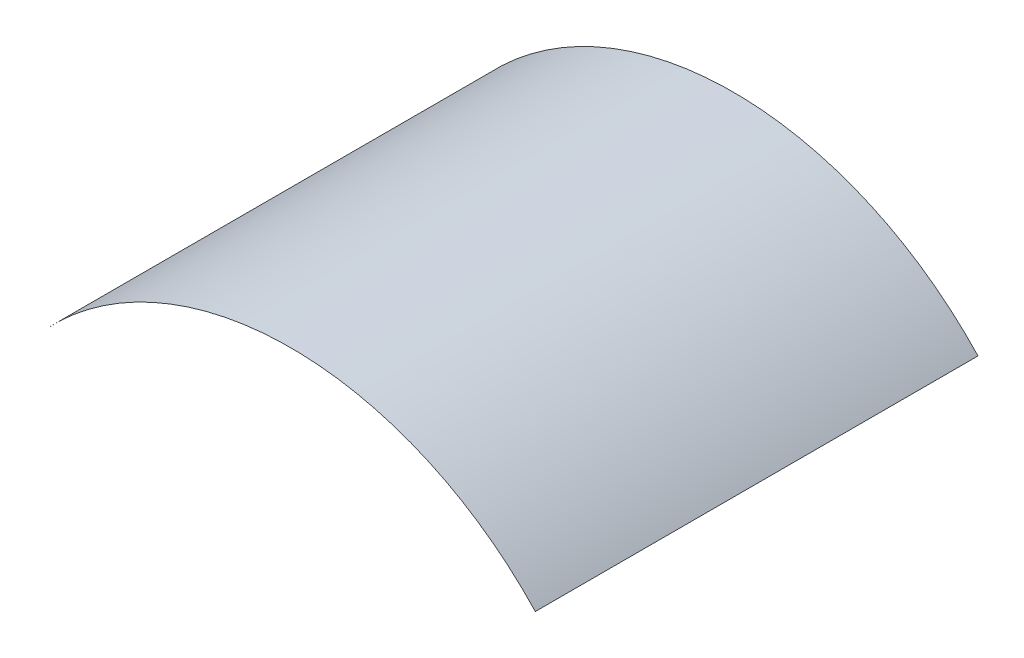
SolidWorks part; units mm, degrees
ref_plane "Front" through (0, 0, 0) normal (0, 0, 1) x (1, 0, 0)
ref_plane "Top" through (0, 0, 0) normal (0, 1, 0) x (1, 0, 0)
ref_plane "Right" through (0, 0, 0) normal (1, 0, 0) x (0, 0, -1)
sketch "Sketch1" plane through (0, 0, 0) normal (0, 0, 1) x (1, 0, 0)
  arc A0 (0, 0) -> (86.2138, 0) centre (43.1069, -40.3163) cw
surface "Surface-Extrude1" sketch "Sketch1" parameters "D1"=78
